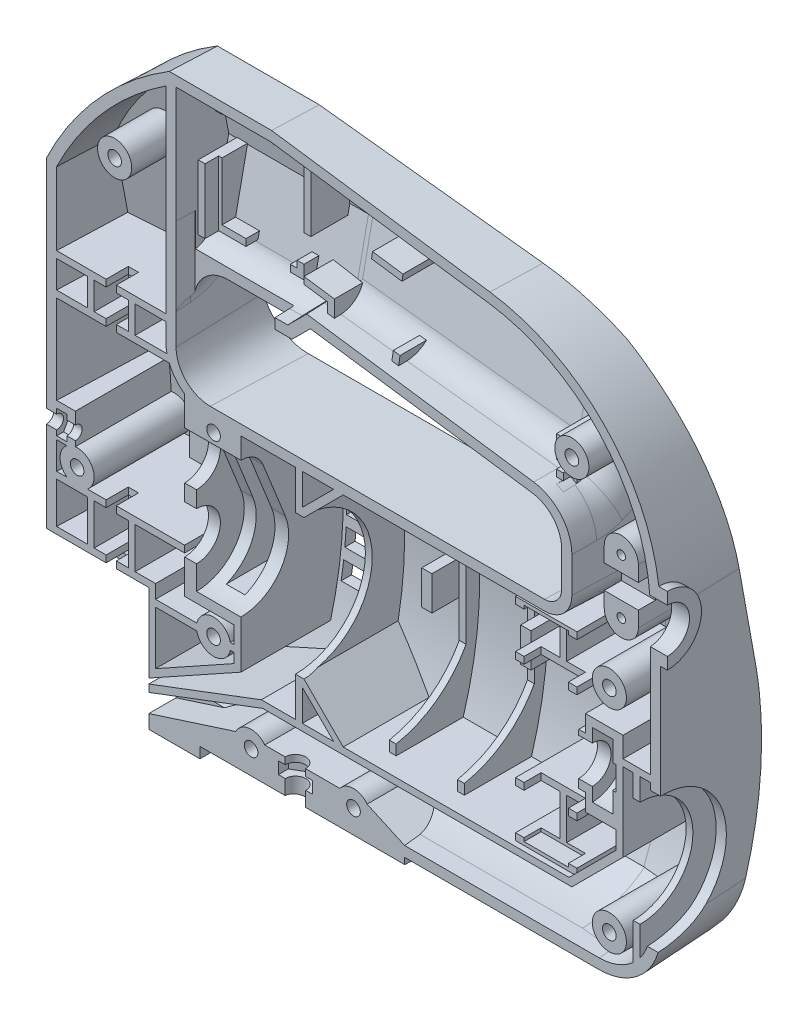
SolidWorks part; units mm, degrees
ref_plane "Plan1" through (0, 0, 0) normal (0, 0, 1) x (1, 0, 0)
ref_plane "Plan2" through (0, 0, 0) normal (0, 1, 0) x (1, 0, 0)
ref_plane "Plan3" through (0, 0, 0) normal (1, 0, 0) x (0, 0, -1)
imported_body "Importée1"
sketch "Esquisse1" plane through (181.9982, 0, 0) normal (1, 0, 0) x (0, 0, -1)
  line L0 (-4.762, 96) -> (9.838, 96) construction
  line L1 (0, 86) -> (0, 106)
  arc A0 (0, 86) -> (0, 106) centre (0, 96) ccw
  arc A1 (0, 106) -> (0, 86) centre (0, 96) ccw construction
extrude "Boss.-Extru.1" add sketch "Esquisse1" against normal up to next
sketch "Esquisse2" plane through (181.9982, 0, 0) normal (1, 0, 0) x (0, 0, -1)
  line L0 (-4.762, 96) -> (9.838, 96) construction
  circle A0 centre (0, 96) radius 6.5
  arc A1 (0, 102.5) -> (0, 89.5) centre (0, 96) ccw construction
  arc A2 (0, 86) -> (0, 106) centre (0, 96) ccw construction
extrude "Enlèv. mat.-Extru.1" cut sketch "Esquisse2" against normal up to next
sketch "Esquisse3" plane through (0, 0, 0) normal (0, 0, 1) x (1, 0, 0)
  line L0 (57, 76.7991) -> (40.5, 76.7991) construction
  circle A0 centre (49, 79.7991) radius 2
  circle A1 centre (49, 28) radius 2 construction
  point P4 (49, 28)
  dimension "D1" = 3
extrude "Enlèv. mat.-Extru.2" cut sketch "Esquisse3" against normal through all
ref_plane "Plan4" through (0, 0, -7) normal (0, 0, 1) x (1, 0, 0)
sketch "Esquisse4" plane through (0, 0, -7) normal (0, 0, 1) x (1, 0, 0)
  line L0 (180, 86) -> (180, 53) construction
  line L1 (154.0018, 130.0415) -> (150.5018, 128.0207)
  line L2 (150.5018, 128.0207) -> (150.5018, 123.9793)
  line L3 (150.5018, 123.9793) -> (154.0018, 121.9585)
  line L4 (154.0018, 121.9585) -> (157.5018, 123.9793)
  line L5 (157.5018, 123.9793) -> (157.5018, 128.0207)
  line L6 (157.5018, 128.0207) -> (154.0018, 130.0415)
  line L7 (20, 139.0415) -> (16.5, 137.0207)
  line L8 (16.5, 137.0207) -> (16.5, 132.9793)
  line L9 (16.5, 132.9793) -> (20, 130.9585)
  line L10 (20, 130.9585) -> (23.5, 132.9793)
  line L11 (23.5, 132.9793) -> (23.5, 137.0207)
  line L12 (23.5, 137.0207) -> (20, 139.0415)
  line L13 (9, 55.0415) -> (5.5, 53.0207)
  line L14 (5.5, 53.0207) -> (5.5, 48.9793)
  line L15 (5.5, 48.9793) -> (9, 46.9585)
  line L16 (9, 46.9585) -> (12.5, 48.9793)
  line L17 (12.5, 48.9793) -> (12.5, 53.0207)
  line L18 (12.5, 53.0207) -> (9, 55.0415)
  line L19 (49, 83.8405) -> (45.5, 81.8198)
  line L20 (45.5, 81.8198) -> (45.5, 77.7784)
  line L21 (45.5, 77.7784) -> (49, 75.7576)
  line L22 (49, 75.7576) -> (52.5, 77.7784)
  line L23 (52.5, 77.7784) -> (52.5, 81.8198)
  line L24 (52.5, 81.8198) -> (49, 83.8405)
  line L25 (49, 23.9585) -> (52.5, 25.9793)
  line L26 (52.5, 25.9793) -> (52.5, 30.0207)
  line L27 (52.5, 30.0207) -> (49, 32.0415)
  line L28 (49, 32.0415) -> (45.5, 30.0207)
  line L29 (45.5, 30.0207) -> (45.5, 25.9793)
  line L30 (45.5, 25.9793) -> (49, 23.9585)
  line L31 (60, 9.0415) -> (56.5, 7.0207)
  line L32 (56.5, 7.0207) -> (56.5, 2.9793)
  line L33 (56.5, 2.9793) -> (60, 0.9585)
  line L34 (60, 0.9585) -> (63.5, 2.9793)
  line L35 (63.5, 2.9793) -> (63.5, 7.0207)
  line L36 (63.5, 7.0207) -> (60, 9.0415)
  line L37 (90, 9.0415) -> (86.5, 7.0207)
  line L38 (86.5, 7.0207) -> (86.5, 2.9793)
  line L39 (86.5, 2.9793) -> (90, 0.9585)
  line L40 (90, 0.9585) -> (93.5, 2.9793)
  line L41 (93.5, 2.9793) -> (93.5, 7.0207)
  line L42 (93.5, 7.0207) -> (90, 9.0415)
  line L43 (165, 15.0415) -> (161.5, 13.0207)
  line L44 (161.5, 13.0207) -> (161.5, 8.9793)
  line L45 (161.5, 8.9793) -> (165, 6.9585)
  line L46 (165, 6.9585) -> (168.5, 8.9793)
  line L47 (168.5, 8.9793) -> (168.5, 13.0207)
  line L48 (168.5, 13.0207) -> (165, 15.0415)
  line L49 (165, 77.0415) -> (161.5, 75.0207)
  line L50 (161.5, 75.0207) -> (161.5, 70.9793)
  line L51 (161.5, 70.9793) -> (165, 68.9585)
  line L52 (165, 68.9585) -> (168.5, 70.9793)
  line L53 (168.5, 70.9793) -> (168.5, 75.0207)
  line L54 (168.5, 75.0207) -> (165, 77.0415)
  circle A0 centre (154.0018, 126) radius 3.5 construction
  circle A1 centre (20, 135) radius 3.5 construction
  circle A2 centre (9, 51) radius 3.5 construction
  circle A3 centre (49, 79.7991) radius 3.5 construction
  circle A4 centre (49, 28) radius 3.5 construction
  circle A5 centre (60, 5) radius 3.5 construction
  circle A6 centre (90, 5) radius 3.5 construction
  circle A7 centre (165, 11) radius 3.5 construction
  circle A8 centre (165, 73) radius 3.5 construction
  dimension "D1" = 7
extrude "Enlèv. mat.-Extru.3" cut sketch "Esquisse4" against normal through all draft 2
sketch "Esquisse6" plane through (0, 0, -7.5) normal (0, 0, -1) x (-1, 0, 0)
  line L12 (-68, 124.2984) -> (-42, 124.2984)
  line L13 (-42, 124.2984) -> (-42, 159.2984)
  line L14 (-42, 159.2984) -> (-73, 159.2984)
  line L15 (-73, 159.2984) -> (-73, 128.2984)
  line L16 (-73, 128.2984) -> (-68, 128.2984)
  line L17 (-68, 128.2984) -> (-68, 124.2984)
  line L18 (-68, 124.2984) -> (-64, 124.2984)
  line L19 (-42, 124.2984) -> (-42, 143.2984)
  line L20 (-42, 159.2984) -> (-47, 159.2984)
  line L21 (-73, 159.2984) -> (-73, 140.2984)
  line L23 (-68, 128.2984) -> (-68, 124.2984)
  line L24 (-47, 159.2984) -> (-47, 157.2984)
  line L25 (-42, 154.2984) -> (-44, 154.2984)
  line L26 (-63, 159.2984) -> (-63, 157.2984)
  line L27 (-71, 140.2984) -> (-73, 140.2984)
  line L28 (-44, 143.2984) -> (-42, 143.2984)
  line L29 (-51, 126.2984) -> (-51, 124.2984)
  line L30 (-66, 126.2984) -> (-44, 126.2984)
  line L31 (-44, 126.2984) -> (-44, 157.2984)
  line L32 (-44, 157.2984) -> (-71, 157.2984)
  line L33 (-71, 157.2984) -> (-71, 130.2984)
  line L34 (-71, 130.2984) -> (-66, 130.2984)
  line L35 (-66, 130.2984) -> (-66, 126.2984)
  line L36 (-66, 126.2984) -> (-64, 126.2984)
  line L37 (-44, 126.2984) -> (-44, 143.2984)
  line L38 (-44, 157.2984) -> (-47, 157.2984)
  line L39 (-71, 157.2984) -> (-71, 140.2984)
  line L41 (-66, 128.2984) -> (-66, 126.2984)
  line L42 (-64, 126.2984) -> (-64, 124.2984)
  line L43 (-68, 128.2984) -> (-66, 128.2984)
  line L44 (-51, 124.2984) -> (-42, 124.2984)
  line L45 (-51, 126.2984) -> (-44, 126.2984)
  line L46 (-44, 154.2984) -> (-44, 157.2984)
  line L47 (-42, 154.2984) -> (-42, 159.2984)
  line L48 (-63, 157.2984) -> (-71, 157.2984)
  line L49 (-63, 159.2984) -> (-73, 159.2984)
  dimension "D3" = 5
  dimension "D4" = 5
  dimension "D5" = 19
  dimension "D6" = 10
  dimension "D7" = 9
  dimension "D8" = 19
  dimension "D9" = 4
  dimension "D1" = 1
  dimension "D2" = 1
extrude "Boss.-Extru.2" add sketch "Esquisse6" along normal up to next
sketch "Esquisse7" plane through (0, 0, -7.5) normal (0, 0, 1) x (1, 0, 0)
  line L0 (51, 124.2984) -> (42, 124.2984) construction
  line L1 (43, 124.2984) -> (42, 124.2984)
  line L6 (43, 125.2984) -> (67, 125.2984)
  line L7 (43, 158.2984) -> (43, 125.2984)
  line L8 (72, 158.2984) -> (43, 158.2984)
  line L9 (72, 129.2984) -> (72, 158.2984)
  line L10 (67, 129.2984) -> (72, 129.2984)
  line L11 (67, 125.2984) -> (67, 129.2984)
  line L13 (43, 143.2984) -> (43, 124.2984)
  line L14 (72, 158.2984) -> (63, 158.2984)
  line L15 (72, 140.2984) -> (72, 158.2984)
  line L18 (73, 159.2984) -> (63, 159.2984)
  line L19 (63, 159.2984) -> (63, 157.2984)
  line L20 (63, 157.2984) -> (71, 157.2984)
  line L21 (71, 157.2984) -> (71, 140.2984)
  line L22 (71, 140.2984) -> (73, 140.2984)
  line L23 (73, 140.2984) -> (73, 159.2984)
  line L24 (73, 159.2984) -> (63, 159.2984)
  line L25 (63, 159.2984) -> (63, 158.2984)
  line L28 (72, 140.2984) -> (73, 140.2984)
  line L29 (73, 140.2984) -> (73, 159.2984)
  line L42 (42, 124.2984) -> (51, 124.2984)
  line L43 (51, 124.2984) -> (51, 126.2984)
  line L44 (51, 126.2984) -> (44, 126.2984)
  line L45 (44, 126.2984) -> (44, 143.2984)
  line L46 (44, 143.2984) -> (42, 143.2984)
  line L47 (42, 143.2984) -> (42, 124.2984)
  line L52 (43, 143.2984) -> (42, 143.2984)
  line L53 (42, 143.2984) -> (42, 124.2984)
  dimension "D1" = 0
  dimension "D2" = 0
  dimension "D4" = 0
extrude "Boss.-Extru.3" add sketch "Esquisse7" along normal blind 4
sketch "Esquisse8" plane through (0, 0, -3.5) normal (0, 0, 1) x (1, 0, 0)
  line L2 (73, 140.2984) -> (73, 159.2984) construction
  line L3 (73, 159.2984) -> (63, 159.2984) construction
  line L4 (74, 140.2984) -> (74, 160.2984)
  line L5 (74, 160.2984) -> (63, 160.2984)
  line L6 (74, 140.2984) -> (74, 160.2984)
  line L7 (74, 160.2984) -> (63, 160.2984)
  line L8 (73, 140.2984) -> (73, 159.2984)
  line L9 (73, 159.2984) -> (63, 159.2984)
  line L10 (63, 159.2984) -> (63, 160.2984)
  line L11 (73, 140.2984) -> (74, 140.2984)
  line L12 (43, 143.2984) -> (42, 143.2984) construction
  line L13 (42, 124.2984) -> (41, 124.2984)
  line L14 (42, 124.2984) -> (42, 143.2984)
  line L15 (42, 143.2984) -> (41, 143.2984)
  line L16 (41, 124.2984) -> (41, 143.2984)
  line L18 (92.0866, 145.5538) -> (101, 144.3085)
  line L19 (92.0866, 145.5538) -> (91.8098, 143.5731)
  line L20 (91.8098, 143.5731) -> (100.7233, 142.3278)
  line L21 (101, 144.3085) -> (100.7233, 142.3278)
  line L22 (146.0018, 126.3113) -> (148.0018, 126.3113)
  line L23 (146.0018, 126.3113) -> (146.0018, 113.3113)
  line L24 (72, 129.1881) -> (80.9123, 127.9348)
  line L25 (148.0018, 126.3113) -> (148.0018, 112.2671)
  line L26 (142.715, 134.283) -> (80.6988, 142.9473) construction
  line L27 (71, 140.2984) -> (71, 157.2984) construction
  line L28 (80.9123, 127.9348) -> (80.9123, 122.8874)
  line L29 (76.292, 123.5372) -> (142.819, 114.1818) construction
  line L30 (78.9318, 123.166) -> (78.9318, 126.2133)
  line L31 (78.9318, 126.2133) -> (72, 127.1881)
  line L32 (72, 127.1881) -> (72, 129.1881)
  line L34 (142.3978, 111.2097) -> (77.3562, 120.3562) construction
  line L35 (78.9318, 123.166) -> (80.9123, 122.8874)
  line L36 (72, 158.2984) -> (72, 140.2984) construction
  line L37 (97.7467, 120.5201) -> (99.7272, 120.2416)
  line L38 (99.7272, 120.2416) -> (100.1449, 123.2124)
  line L39 (100.1449, 123.2124) -> (98.1644, 123.4909)
  line L40 (97.7467, 120.5201) -> (98.1644, 123.4909)
  circle A0 centre (154.0018, 126) radius 2 construction
  ellipse E0 centre (140.9939, 101.3026) end of major axis (131.1718, 92.7651) minor radius 13 (154.0018, 101.3163) -> (142.819, 114.1818) ccw construction
  ellipse E1 centre (140.9939, 101.3026) end of major axis (131.1718, 92.7651) minor radius 13 (148.0018, 112.2671) -> (146.0018, 113.3113) ccw
  dimension "D2" = 2.1572
  dimension "D3" = 9
  dimension "D4" = 2
  dimension "D5" = 30
  dimension "D6" = 13
  dimension "D7" = 8
  dimension "D8" = 8
  dimension "D9" = 9
  dimension "D10" = 17
  dimension "D11" = 3
  dimension "D1" = 1
extrude "Boss.-Extru.4" add sketch "Esquisse8" against normal up to next
sketch "Esquisse9" plane through (0, 0, -3.5) normal (0, 0, 1) x (1, 0, 0)
  line L0 (148.0018, 115.3113) -> (148.0018, 112.4504)
  line L1 (146.0018, 124.3113) -> (148.0018, 124.3113)
  line L2 (146.0018, 124.3113) -> (146.0018, 121.8113)
  line L3 (146.0018, 121.8113) -> (148.0018, 121.8113)
  line L4 (148.0018, 124.3113) -> (148.0018, 121.8113)
  line L5 (146.0018, 126.3113) -> (146.0018, 113.4677) construction
  line L6 (146.0018, 119.8113) -> (148.0018, 119.8113)
  line L7 (146.0018, 119.8113) -> (146.0018, 117.3113)
  line L8 (146.0018, 117.3113) -> (148.0018, 117.3113)
  line L9 (148.0018, 119.8113) -> (148.0018, 117.3113)
  line L10 (148.0018, 112.4504) -> (148.0018, 126.3113) construction
  line L11 (148.0018, 126.3113) -> (146.0018, 126.3113) construction
  line L12 (146.0018, 115.3113) -> (148.0018, 115.3113)
  line L13 (146.0018, 115.3113) -> (146.0018, 113.4677)
  line L16 (147.0018, 121.8113) -> (147.0018, 119.8113) construction
  line L17 (147.0018, 117.3113) -> (147.0018, 115.3113) construction
  line L18 (147.0018, 124.3113) -> (147.0018, 126.3113) construction
  ellipse E0 centre (141.1161, 101.4088) end of major axis (131.2941, 92.8713) minor radius 13 (148.0018, 112.4504) -> (146.0018, 113.4677) ccw construction
  ellipse E2 centre (141.1161, 101.4088) end of major axis (131.2941, 92.8713) minor radius 13 (148.0018, 112.4504) -> (146.0018, 113.4677) ccw
  dimension "D1" = 2.5
  dimension "D2" = 2
extrude "Enlèv. mat.-Extru.4" cut sketch "Esquisse9" against normal blind 4
